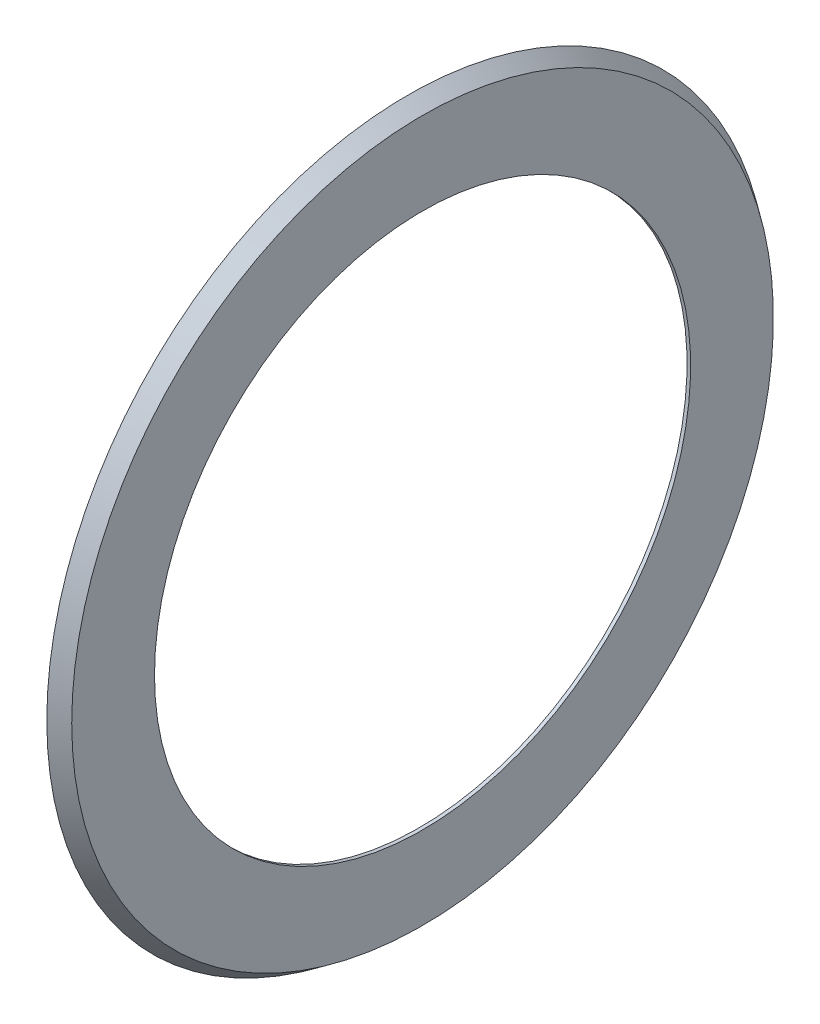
SolidWorks part; units mm, degrees
ref_plane "Face" through (0, 0, 0) normal (0, 0, 1) x (1, 0, 0)
ref_plane "Dessus" through (0, 0, 0) normal (0, 1, 0) x (1, 0, 0)
ref_plane "Droite" through (0, 0, 0) normal (1, 0, 0) x (0, 0, -1)
sketch "Esquisse1" plane through (0, 0, 0) normal (0, 0, 1) x (1, 0, 0)
  line L0 (9, 14.494) -> (9.85, 13.8988)
  line L1 (9.85, 13.8988) -> (9.85, 11.254)
  line L2 (9.85, 11.254) -> (10, 11.254)
  line L3 (10, 11.254) -> (10, 14.729)
  line L4 (10, 14.729) -> (9.3845, 15.16)
  line L5 (9.3845, 15.16) -> (9, 14.494)
  line L6 (10, 0) -> (9, 0) construction
revolve "Révolution1" add sketch "Esquisse1" angle 360 about L6
